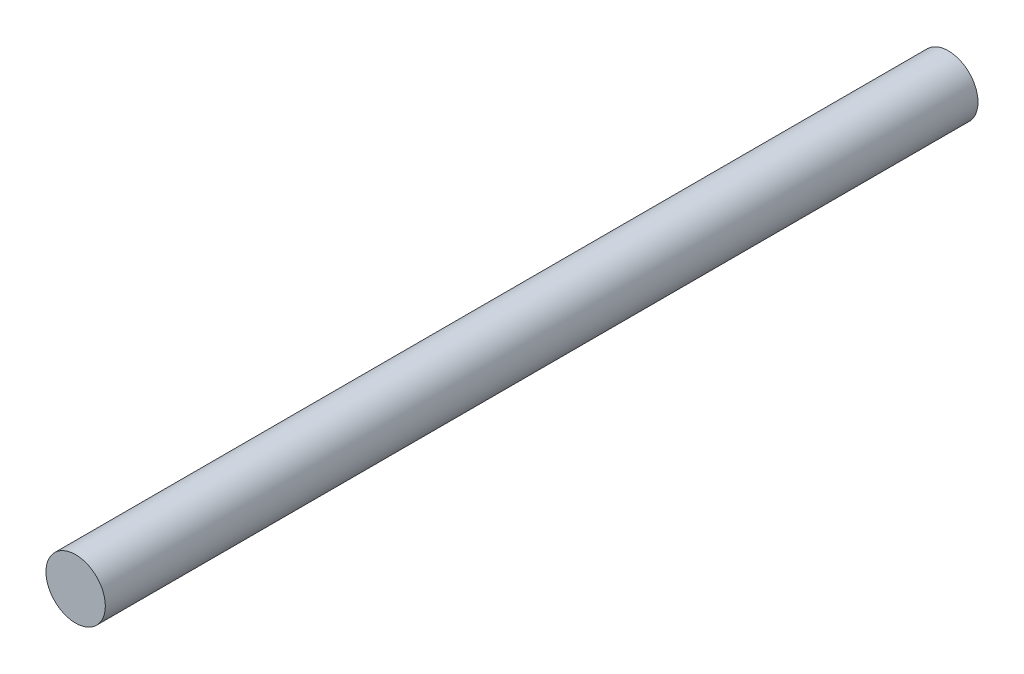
SolidWorks part; units mm, degrees
ref_plane "Plan de face" through (0, 0, 0) normal (0, 0, 1) x (1, 0, 0)
ref_plane "Plan de dessus" through (0, 0, 0) normal (0, 1, 0) x (1, 0, 0)
ref_plane "Plan de droite" through (0, 0, 0) normal (1, 0, 0) x (0, 0, -1)
ref_plane "Plan1" through (41.8723, 0, 0) normal (1, 0, 0) x (0, 0, -1)
sketch "Esquisse2" plane through (41.8723, 0, 0) normal (1, 0, 0) x (0, 0, -1)
  line L0 (-104.9153, 63.5844) -> (-295.6153, 63.5844) construction
  line L1 (-110.9153, 63.5844) -> (-280.6153, 63.5844)
  line L2 (-110.9153, 54.8111) -> (-110.9153, 52.0378)
  line L3 (-295.6153, 52.0378) -> (-104.9153, 52.0378) construction
  line L4 (-33.6153, 60.8111) -> (-177.1153, 60.8111) construction
  line L5 (-110.9153, 60.8111) -> (-177.1153, 60.8111)
  line L6 (-177.1153, 60.53) -> (-180.6153, 60.53) construction
  line L7 (-177.1153, 60.53) -> (-180.6153, 60.53)
  line L8 (-182.1153, 59.03) -> (-182.1153, 56.03) construction
  line L9 (-182.1153, 59.03) -> (-182.1153, 56.03)
  line L10 (-180.6153, 54.53) -> (-177.1153, 54.53) construction
  line L11 (-180.6153, 54.53) -> (-177.1153, 54.53)
  line L12 (-177.1153, 54.8111) -> (-33.6153, 54.8111) construction
  line L13 (-177.1153, 54.8111) -> (-110.9153, 54.8111)
  line L14 (-177.1153, 54.53) -> (-177.1153, 60.1426) construction
  line L15 (-177.1153, 54.53) -> (-177.1153, 54.8111)
  line L16 (-110.9153, 63.5611) -> (-110.9153, 52.0611) construction
  line L17 (-110.9153, 63.5844) -> (-110.9153, 60.8111)
  line L18 (-280.6153, 52.0378) -> (-110.9153, 52.0378)
  line L19 (-280.6153, 51.5611) -> (-280.6153, 64.0611) construction
  line L20 (-280.6153, 52.0378) -> (-280.6153, 63.5844)
  arc A0 (-180.6153, 60.53) -> (-182.1153, 59.03) centre (-180.6153, 59.03) ccw construction
  arc A1 (-180.6153, 60.53) -> (-182.1153, 59.03) centre (-180.6153, 59.03) ccw
  arc A2 (-182.1153, 56.03) -> (-180.6153, 54.53) centre (-180.6153, 56.03) ccw construction
  arc A3 (-182.1153, 56.03) -> (-180.6153, 54.53) centre (-180.6153, 56.03) ccw
  point P16 (-177.1153, 54.9874)
  point P20 (-110.9153, 64.4197)
  point P28 (-110.9153, 50.4156)
sketch "Esquisse3" plane through (41.8723, 0, 0) normal (1, 0, 0) x (0, 0, -1)
  line L0 (-110.9153, 63.5844) -> (-280.6153, 63.5844) construction
  line L1 (-110.9153, 63.5844) -> (-280.6153, 63.5844)
  line L2 (-110.9153, 60.8111) -> (-177.1153, 60.8111) construction
  line L3 (-110.9153, 60.8111) -> (-177.1153, 60.8111)
  line L4 (-280.6153, 63.5844) -> (-280.6153, 57.8111)
  line L8 (-110.9153, 63.5844) -> (-110.9153, 60.8111) construction
  line L9 (-110.9153, 63.5844) -> (-110.9153, 60.8111)
  line L12 (-280.6153, 52.0378) -> (-280.6153, 63.5844) construction
  line L13 (-280.6153, 52.0378) -> (-280.6153, 63.5844) construction
  line L14 (-280.6153, 57.8111) -> (-107.4605, 57.8111) construction
  line L15 (-177.1153, 60.8111) -> (-177.1153, 57.8111)
  line L16 (-177.1153, 57.8111) -> (-280.6153, 57.8111)
revolve "Révolution1" add sketch "Esquisse3" angle 360 about L14
sketch "Esquisse4" plane through (41.8723, 0, 0) normal (1, 0, 0) x (0, 0, -1)
  line L0 (-177.1153, 60.53) -> (-180.6153, 60.53) construction
  line L1 (-177.1153, 60.53) -> (-180.6153, 60.53)
  line L2 (-182.1153, 59.03) -> (-182.1153, 56.03) construction
  line L3 (-182.1153, 59.03) -> (-182.1153, 56.03) construction
  line L4 (-182.1153, 57.53) -> (-175.3583, 57.53) construction
  line L5 (-182.1153, 59.03) -> (-182.1153, 57.53)
  line L6 (-182.1153, 57.53) -> (-177.1153, 57.53)
  line L7 (-177.1153, 57.53) -> (-177.1153, 60.53)
  arc A0 (-180.6153, 60.53) -> (-182.1153, 59.03) centre (-180.6153, 59.03) ccw construction
  arc A1 (-180.6153, 60.53) -> (-182.1153, 59.03) centre (-180.6153, 59.03) ccw
revolve "Enlèvement de matière-Révolution1" cut sketch "Esquisse4" angle 360 about L4
